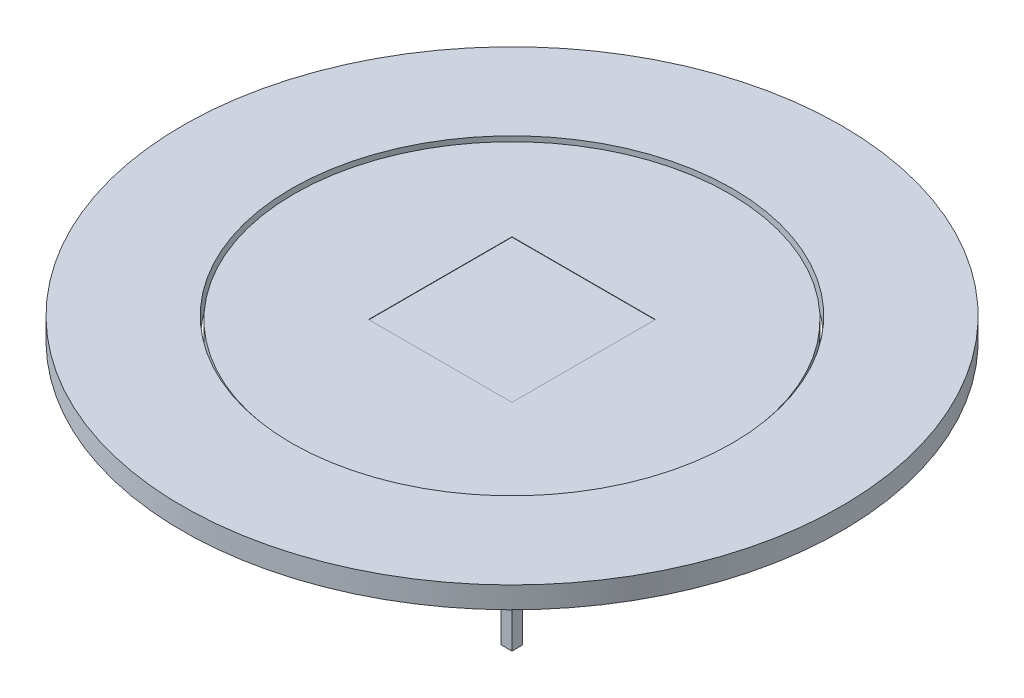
SolidWorks part; units mm, degrees
ref_plane "Front Plane" through (0, 0, 0) normal (0, 0, 1) x (1, 0, 0)
ref_plane "Top Plane" through (0, 0, 0) normal (0, 1, 0) x (1, 0, 0)
ref_plane "Right Plane" through (0, 0, 0) normal (1, 0, 0) x (0, 0, -1)
sketch "Sketch1" plane through (0, 0, 0) normal (0, 1, 0) x (1, 0, 0)
  line L1 (0, 0) -> (40, 0)
  line L2 (0, 0) -> (0, 40)
  line L3 (0, 40) -> (40, 40)
  line L4 (40, 0) -> (40, 40)
  dimension "D1" = 40
  dimension "D2" = 40
extrude "Boss-Extrude1" add sketch "Sketch1" along normal blind 5 contours L1 L4 L3 L2
sketch "Sketch2" plane through (0, 0, 0) normal (0, -1, 0) x (1, 0, 0)
  line L1 (0, 0) -> (3, 0)
  line L2 (0, 0) -> (0, -3)
  line L3 (0, -3) -> (3, -3)
  line L4 (3, 0) -> (3, -3)
  line L5 (0, -40) -> (3, -40)
  line L6 (0, -40) -> (0, -37)
  line L7 (0, -37) -> (3, -37)
  line L8 (3, -40) -> (3, -37)
  line L9 (40, 0) -> (37, 0)
  line L10 (40, 0) -> (40, -3)
  line L11 (40, -3) -> (37, -3)
  line L12 (37, 0) -> (37, -3)
  line L13 (40, -40) -> (37, -40)
  line L14 (40, -40) -> (40, -37)
  line L15 (40, -37) -> (37, -37)
  line L16 (37, -40) -> (37, -37)
  dimension "D1" = 3
  dimension "D2" = 3
  dimension "D3" = 3
  dimension "D4" = 3
  dimension "D5" = 3
  dimension "D6" = 3
extrude "Boss-Extrude2" add sketch "Sketch2" along normal blind 55 contours L15 L16 L13 L14
sketch "Sketch7" plane through (0, 0, 0) normal (0, -1, 0) x (1, 0, 0)
  line L0 (21.7426, 28) -> (23.7918, 28)
  line L1 (15.7918, -2) -> (23.7918, -2)
  line L2 (15.7918, -2) -> (15.7918, 28)
  line L3 (15.7918, 28) -> (17.7545, 28)
  line L4 (23.7918, -2) -> (23.7918, 28)
  line L5 (11.9553, -2) -> (1.5246, 26.1283)
  line L6 (17.7545, 28) -> (17.7545, 58)
  line L7 (17.7545, 58) -> (21.7426, 58)
  line L8 (21.7426, 28) -> (21.7426, 58)
  line L9 (11.9553, -2) -> (4.4545, -4.7815)
  line L10 (1.5246, 26.1283) -> (-0.0834, 25.532)
  line L11 (4.4545, -4.7815) -> (-5.9763, 23.3467)
  line L12 (-0.0834, 25.532) -> (-10.5142, 53.6602)
  line L13 (37, -3) -> (40, -3) construction
  line L14 (-10.5142, 53.6602) -> (-14.2646, 52.2695)
  line L15 (-3.8338, 24.1412) -> (-14.2646, 52.2695)
  line L16 (-3.8338, 24.1412) -> (-5.9763, 23.3467)
  line L17 (26.7918, -2) -> (39.1247, 26.1283)
  line L18 (26.7918, -2) -> (34.1185, -5.2124)
  line L19 (39.1247, 26.1283) -> (40.802, 25.3929)
  line L20 (34.1185, -5.2124) -> (46.4514, 22.9159)
  line L21 (40.802, 25.3929) -> (53.1958, 53.6602)
  line L23 (53.1958, 53.6602) -> (57.4289, 51.8042)
  line L24 (45.035, 23.5369) -> (57.4289, 51.8042)
  line L25 (45.035, 23.5369) -> (46.4514, 22.9159)
  dimension "D1" = 8
  dimension "D2" = 30
  dimension "D3" = 30
  dimension "D4" = 8
  dimension "D5" = 30
  dimension "D6" = 4
  dimension "D7" = 30
  dimension "D8" = 0
  dimension "D9" = 1
  dimension "D10" = 8
  dimension "D11" = 3
extrude "Boss-Extrude7" add sketch "Sketch7" along normal blind 2 contours L4 L0 L8 L7 L6 L3 L2 L1
sketch "Sketch3" plane through (0, 0, 0) normal (0, 1, 0) x (1, 0, 0)
  line L0 (0, 40) -> (-22.9655, 62.9655) construction
  line L1 (40, 40) -> (62.9655, 62.9655) construction
  line L2 (40, 0) -> (62.9655, -22.9655) construction
  line L3 (0, 0) -> (-22.9655, -22.9655) construction
  line L5 (0, 40) -> (40, 40)
  line L6 (0, 40) -> (0, 0)
  line L7 (0, 0) -> (40, 0)
  line L8 (40, 40) -> (40, 0)
  arc A0 (-22.9655, 62.9655) -> (62.9655, 62.9655) centre (20, 20) cw
  arc A1 (62.9655, 62.9655) -> (62.9655, -22.9655) centre (20, 20) cw
  arc A2 (62.9655, -22.9655) -> (-22.9655, -22.9655) centre (20, 20) cw
  arc A3 (-22.9655, 62.9655) -> (-22.9655, -22.9655) centre (20, 20) ccw
extrude "Boss-Extrude3" add sketch "Sketch3" along normal blind 5.1 contours A0 L1 L5 L0
sketch "Sketch4" plane through (0, 0, 0) normal (0, -1, 0) x (1, 0, 0)
  line L0 (24.0871, -21.8258) -> (64.7945, -30)
  line L1 (24.0871, -15.6134) -> (66.1024, -15.6134)
  line L2 (24.0871, -15.6134) -> (24.0871, -18.8831)
  line L3 (24.0871, -18.8831) -> (66.1024, -18.8831)
  line L4 (66.1024, -15.6134) -> (66.1024, -18.8831)
  line L5 (24.0871, -21.8258) -> (23.2537, -25.976)
  line L6 (64.7945, -30) -> (63.9611, -34.1502)
  line L7 (23.2537, -25.976) -> (63.9611, -34.1502)
  line L8 (24.0871, -11.0359) -> (62.1788, 0)
  line L9 (24.0871, -11.0359) -> (25.2085, -14.9066)
  line L10 (62.1788, 0) -> (63.3002, -3.8707)
  line L11 (25.2085, -14.9066) -> (63.3002, -3.8707)
extrude "Boss-Extrude4" add sketch "Sketch4" along normal blind 2 contours L8 L10 L11 L9
sketch "Sketch5" plane through (0, 0, 0) normal (0, -1, 0) x (1, 0, 0)
  line L0 (40, 0) -> (62.9655, 22.9655) construction
  line L1 (40, -40) -> (62.9655, -62.9655) construction
  line L2 (62.9655, 22.9655) -> (63.4862, 23.4862)
  line L3 (62.9655, -62.9655) -> (63.4862, -63.4862) construction
  line L4 (79.405, -4.0895) -> (78.6938, -4.2801)
  line L5 (79.405, -35.9105) -> (78.6938, -35.7199) construction
  line L7 (0, 0) -> (40, 0) construction
  circle A0 centre (20, -20) radius 60.7625 construction
  arc A1 (108.8244, 3.7934) -> (85.0179, 45.0179) centre (20.0263, -20) ccw
  arc A2 (108.8244, 3.7934) -> (108.8244, -43.7934) centre (20.0263, -20) cw construction
  arc A3 (108.8244, -43.7934) -> (85.0179, -85.0179) centre (20.0263, -20) cw construction
  arc A4 (62.9655, 22.9655) -> (78.6938, -4.2801) centre (20, -20) cw
  circle A5 centre (20.0263, -20) radius 91.9305
  circle A6 centre (20, -20) radius 61.4988
  point P20 (108.8244, -43.7934)
  point P21 (108.8244, 3.7934)
  dimension "D1" = 30
  dimension "D2" = 30
  dimension "D3" = 30
  dimension "D4" = 45
extrude "Boss-Extrude5" add sketch "Sketch5" against normal blind 6 separate body contours A1 A5 A6
sketch "Sketch6" plane through (0, 0, 0) normal (0, -1, 0) x (1, 0, 0)
  line L0 (71.7334, -26.8899) -> (102.7759, -39.0693)
  line L1 (70.4403, -14.5088) -> (102.7759, -14.5088)
  line L2 (70.4403, -14.5088) -> (70.4403, -18.5088)
  line L3 (70.4403, -18.5088) -> (102.7759, -18.5088)
  line L4 (102.7759, -14.5088) -> (102.7759, -18.5088)
  line L5 (71.7334, -26.8899) -> (70.1641, -30.8899)
  line L6 (102.7759, -39.0693) -> (101.2066, -43.0693)
  line L7 (70.1641, -30.8899) -> (101.2066, -43.0693)
  dimension "D1" = 4
  dimension "D2" = 4
extrude "Boss-Extrude6" add sketch "Sketch6" along normal blind 2 contours L1 L4 L3 L2
